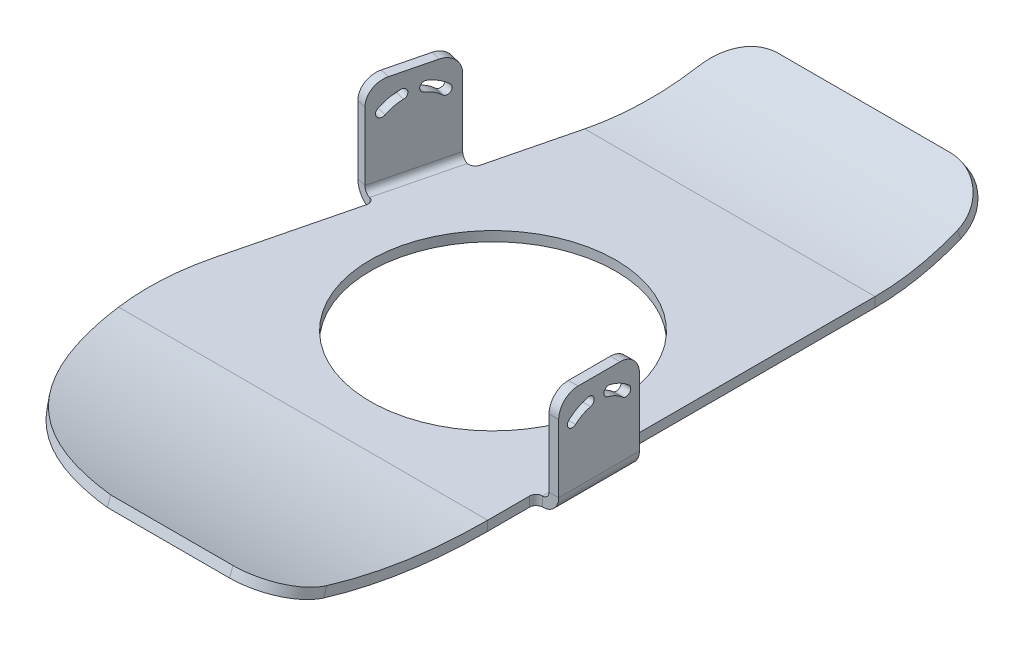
SolidWorks part; units mm, degrees
other "<Binding Base Plate_&>-<Process-Bends1>"
ref_plane "Front Plane" through (0, 0, 0) normal (0, 0, 1) x (1, 0, 0)
ref_plane "Top Plane" through (0, 0, 0) normal (0, 1, 0) x (1, 0, 0)
ref_plane "Right Plane" through (0, 0, 0) normal (1, 0, 0) x (0, 0, -1)
mirrored part "Binding Base Plate_&_Mirrored"
